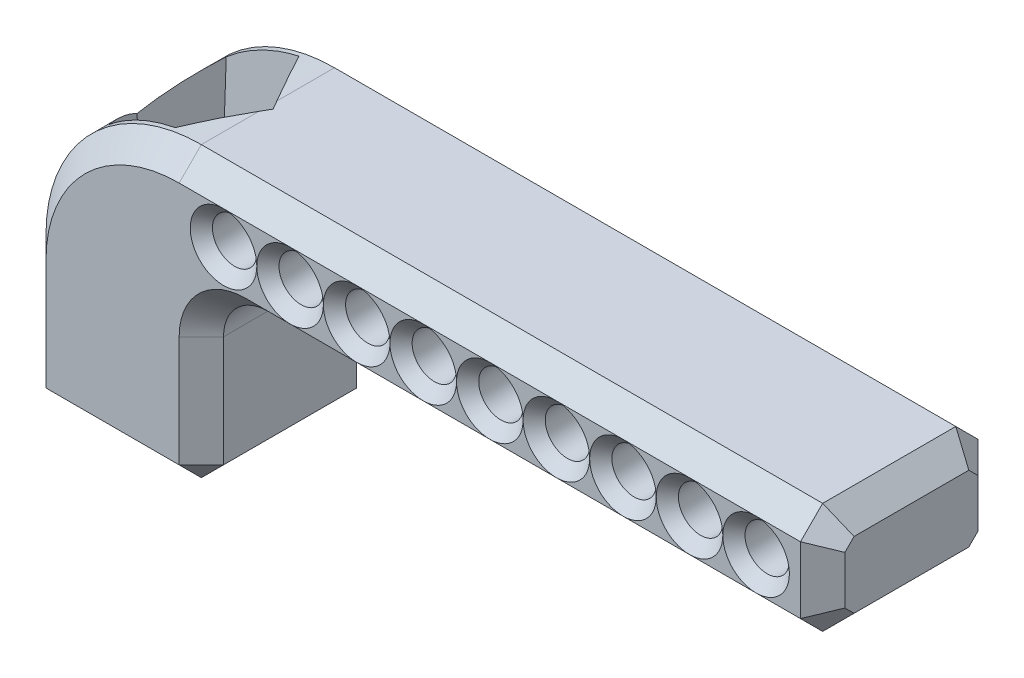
SolidWorks part; units mm, degrees
ref_plane "Front Plane" through (0, 0, 0) normal (0, 0, 1) x (1, 0, 0)
ref_plane "Top Plane" through (0, 0, 0) normal (0, 1, 0) x (1, 0, 0)
ref_plane "Right Plane" through (0, 0, 0) normal (1, 0, 0) x (0, 0, -1)
sketch "Sketch1" plane through (0, 0, 0) normal (0, 0, 1) x (1, 0, 0)
  line L1 (0, 0) -> (114.3, 0)
  line L2 (0, 0) -> (0, 15.875)
  line L3 (0, 15.875) -> (114.3, 15.875)
  line L4 (114.3, 0) -> (114.3, 15.875)
  line L5 (0, 0) -> (25.4, 0)
  line L6 (0, 0) -> (0, -25.4)
  line L7 (0, -25.4) -> (25.4, -25.4)
  line L8 (25.4, 0) -> (25.4, -25.4)
  dimension "D1" = 114.3
  dimension "D2" = 15.875
  dimension "D3" = 25.4
  dimension "D4" = 25.4
extrude "Boss-Extrude1" add sketch "Sketch1" along normal mid plane 25.4 contours L1 L4 L3 L2 | L8 L1 L6 L7
sketch "Sketch3" plane through (0, -25.4, 0) normal (0, -1, 0) x (1, 0, 0)
  line L0 (0, 0) -> (25.4, 0) construction
  line L1 (0, 12.7) -> (0, -12.7) construction
  line L2 (25.4, 12.7) -> (25.4, -12.7) construction
  circle A0 centre (12.7, 0) radius 3.5719
  dimension "D1" = 7.1437
extrude "Cut-Extrude1" cut sketch "Sketch3" against normal through all
fillet "Fillet2" radius 6.35 1 edges at (25.4, 0, 0)
fillet "Fillet3" radius 22.225 1 edges at (0, 15.875, 0)
chamfer "Chamfer1" distance 3.175 angle 45 16 edges at (68.2625, 15.875, -12.7) (68.2625, 15.875, 12.7) (25.4, -15.875, -12.7) (27.2599, -1.8599, -12.7) (73.025, 0, -12.7) (25.4, -15.875, 12.7) (27.2599, -1.8599, 12.7) (73.025, 0, 12.7) (0, -15.875, -12.7) (0, -15.875, 12.7) (6.5096, 9.3654, -12.7) (6.5096, 9.3654, 12.7) (0, -25.4, 0) (12.7, -25.4, 12.7) (25.4, -25.4, 0) (12.7, -25.4, -12.7)
chamfer "Chamfer2" distance 3.175 angle 45 8 edges at (114.3, 1.5875, -11.1125) (114.3, 0, 0) (114.3, 1.5875, 11.1125) (114.3, 7.9375, 12.7) (114.3, 14.2875, 11.1125) (114.3, 15.875, 0) (114.3, 14.2875, -11.1125) (114.3, 7.9375, -12.7)
ref_plane "Plane1" through (0, -22.225, 0) normal (0, -1, 0) x (-1, 0, 0)
sketch "Sketch4" plane through (0, -22.225, 0) normal (0, -1, 0) x (-1, 0, 0)
  line L1 (-9.4921, 5.5562) -> (-15.9079, 5.5562)
  line L2 (-15.9079, 5.5562) -> (-19.1158, 0)
  line L3 (-19.1158, 0) -> (-15.9079, -5.5562)
  line L4 (-15.9079, -5.5562) -> (-9.4921, -5.5562)
  line L5 (-9.4921, -5.5562) -> (-6.2842, 0)
  line L6 (-6.2842, 0) -> (-9.4921, 5.5562)
  circle A0 centre (-12.7, 0) radius 5.5562 construction
  circle A1 centre (-12.7, 0) radius 3.5719 construction
  dimension "D1" = 11.1125
extrude "Cut-Extrude2" cut sketch "Sketch4" against normal blind 43.18 draft 5
sketch "Sketch5" plane through (0, 0, -12.7) normal (0, 0, -1) x (-1, 0, 0)
  line L0 (-111.125, 7.9375) -> (-66.5322, 7.9375) construction
  line L1 (-111.125, 12.7) -> (-111.125, 3.175) construction
  circle A0 centre (-104.775, 7.9375) radius 3.175
  dimension "D1" = 6.35
  dimension "D2" = 6.35
extrude "Cut-Extrude3" cut sketch "Sketch5" against normal through all
pattern_linear "LPattern2" count 9 spacing 9.525 along (-1, 0, 0) of "Cut-Extrude3"
chamfer "Chamfer3" distance 1.5875 angle 45 18 edges at (101.6, 7.9375, -12.7) (25.4, 7.9375, -12.7) (25.4, 7.9375, 12.7) (34.925, 7.9375, -12.7) (34.925, 7.9375, 12.7) (44.45, 7.9375, -12.7) (44.45, 7.9375, 12.7) (53.975, 7.9375, -12.7) (53.975, 7.9375, 12.7) (63.5, 7.9375, -12.7) (63.5, 7.9375, 12.7) (73.025, 7.9375, -12.7) (73.025, 7.9375, 12.7) (82.55, 7.9375, -12.7) (82.55, 7.9375, 12.7) (92.075, 7.9375, -12.7) (92.075, 7.9375, 12.7) (101.6, 7.9375, 12.7)
